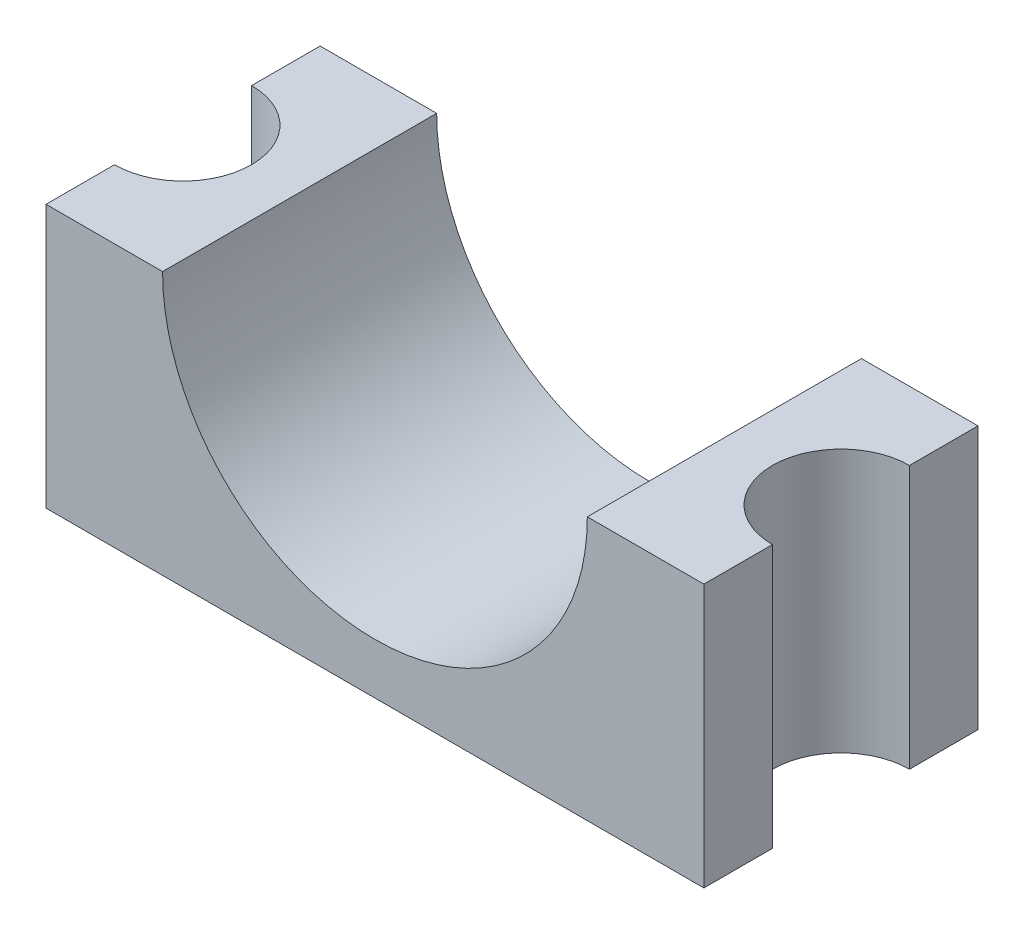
SolidWorks part; units mm, degrees
ref_plane "FRONT" through (0, 0, 0) normal (0, 0, 1) x (1, 0, 0)
ref_plane "TOP" through (0, 0, 0) normal (0, 1, 0) x (1, 0, 0)
ref_plane "RIGHT" through (0, 0, 0) normal (1, 0, 0) x (0, 0, -1)
sketch "Sketch1"
  dimension "D1" = 76.2
  dimension "D2" = 60.96
extrude "Base-Extrude" add sketch "Sketch1" against normal blind 31.75
sketch "Sketch2"
  dimension "D1" = 49.1998
extrude "Cut-Extrude1" cut sketch "Sketch2" against normal through all
sketch "Sketch3"
  dimension "D1" = 15.875
extrude "Cut-Extrude2" cut sketch "Sketch3" against normal through all
sketch "Sketch4"
extrude "Cut-Extrude3" cut sketch "Sketch4" against normal through all and the other way through all
chamfer "Chamfer1" [suppressed] distance 0.762 angle 45
